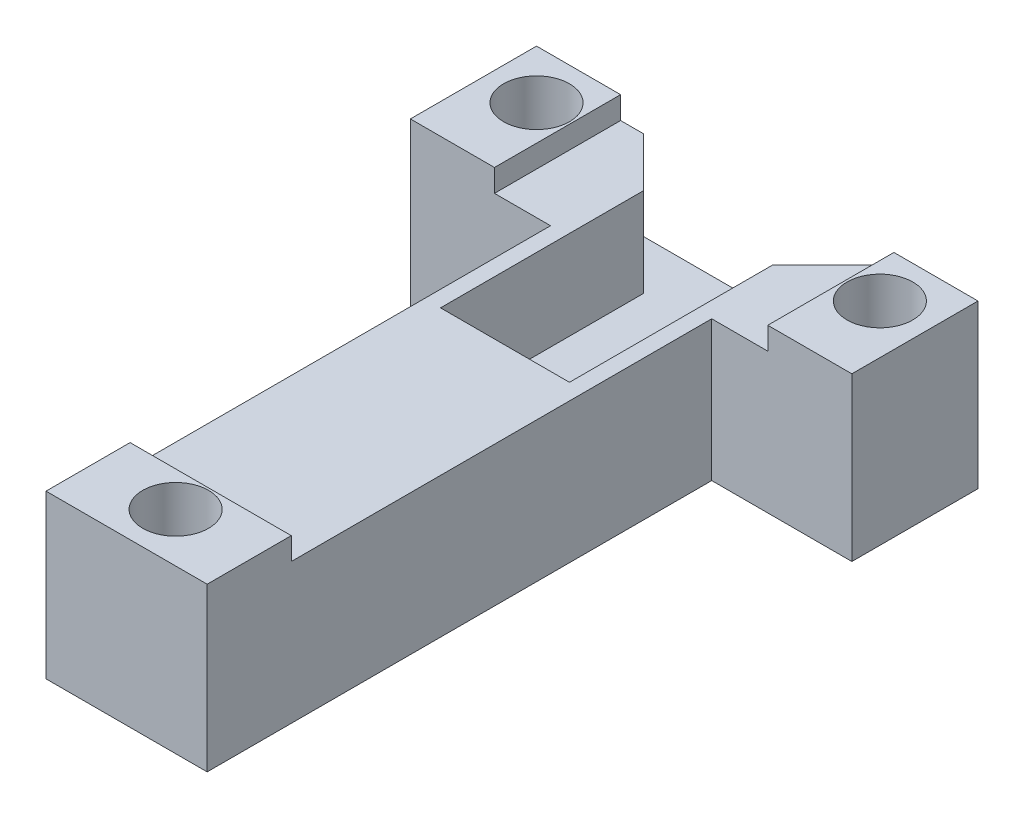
SolidWorks part; units mm, degrees
ref_plane "Front Plane" through (0, 0, 0) normal (0, 0, 1) x (1, 0, 0)
ref_plane "Top Plane" through (0, 0, 0) normal (0, 1, 0) x (1, 0, 0)
ref_plane "Right Plane" through (0, 0, 0) normal (1, 0, 0) x (0, 0, -1)
sketch "Sketch1" plane through (0, 0, 0) normal (0, 1, 0) x (1, 0, 0)
  line L0 (11.5, 45) -> (21.5, 45)
  line L1 (0, 0) -> (11.5, 0)
  line L2 (0, 0) -> (0, 45)
  line L3 (0, 45) -> (11.5, 45)
  line L4 (11.5, 0) -> (11.5, 45)
  line L5 (21.5, 45) -> (21.5, 36)
  line L6 (21.5, 36) -> (11.5, 36)
  line L7 (0, 45) -> (-10, 45)
  line L8 (-10, 45) -> (-10, 36)
  line L9 (-10, 36) -> (0, 36)
  dimension "D3" = 9
  dimension "D1" = 45
  dimension "D2" = 11.5
  dimension "D4" = 10
  dimension "D5" = 10
extrude "Boss-Extrude1" add sketch "Sketch1" along normal blind 10 contours L8 L9 L2 L7 | L6 L5 L0 L4
sketch "Sketch2" plane through (0, 10, 0) normal (0, 1, 0) x (1, 0, 0)
  line L0 (5.75, 0) -> (5.75, 45) construction
  line L3 (0, 36) -> (11.5, 36) construction
  line L4 (5.75, 36) -> (5.75, 27)
  line L5 (1.15, 27) -> (10.35, 27)
  line L6 (1.15, 27) -> (1.15, 45)
  line L7 (21.5, 45) -> (-10, 45) construction
  line L8 (10.35, 27) -> (10.35, 45)
  line L9 (1.15, 45) -> (10.35, 45)
  line L10 (0, 0) -> (11.5, 0) construction
  line L11 (-10, 45) -> (-10, 36) construction
  line L12 (21.5, 45) -> (21.5, 36) construction
  line L13 (1.15, 41.5) -> (-2.35, 45)
  line L14 (10.35, 41.5) -> (13.85, 45)
  circle A0 centre (5.75, 3.5) radius 2.3495
  circle A1 centre (-6.5, 41.5) radius 2.3495
  circle A2 centre (18, 41.5) radius 2.3495
  point P17 (5.75, 27)
  dimension "D1" = 4.699
  dimension "D9" = 4.699
  dimension "D10" = 4.699
  dimension "D2" = 9
  dimension "D3" = 9.2
  dimension "D4" = 3.5
  dimension "D5" = 3.5
  dimension "D6" = 3.5
  dimension "D7" = 3.5
  dimension "D8" = 3.5
  dimension "D11" = 3.5
  dimension "D12" = 3.5
  dimension "D13" = 3.5
  dimension "D14" = 3.5
extrude "Cut-Extrude1" cut sketch "Sketch2" against normal blind 6.35
sketch "Sketch3" plane through (0, 0, 0) normal (0, -1, 0) x (1, 0, 0)
  line L0 (5.75, 0) -> (5.75, -45) construction
  line L1 (0, 0) -> (11.5, 0) construction
  line L2 (21.5, -45) -> (-10, -45) construction
  circle A0 centre (5.75, -10) radius 2.3495
  circle A1 centre (5.75, -22) radius 2.3495
  dimension "D3" = 4.699
  dimension "D4" = 4.699
  dimension "D1" = 10
  dimension "D2" = 12
extrude "Cut-Extrude2" cut sketch "Sketch3" against normal blind 6.35
sketch "Sketch4" plane through (0, 10, 0) normal (0, 1, 0) x (1, 0, 0)
  line L0 (-4, 36) -> (-4, 45)
  line L1 (-10, 36) -> (0, 36) construction
  line L2 (-2.35, 45) -> (-10, 45) construction
  line L3 (15.5, 36) -> (15.5, 45)
  line L4 (21.5, 36) -> (11.5, 36) construction
  line L5 (21.5, 45) -> (13.85, 45) construction
  line L6 (0, 6) -> (11.5, 6)
  line L7 (0, 0) -> (0, 36) construction
  line L8 (11.5, 0) -> (11.5, 36) construction
  line L9 (0, 0) -> (11.5, 0) construction
  line L10 (-10, 45) -> (-10, 36) construction
  line L11 (21.5, 45) -> (21.5, 36) construction
  dimension "D1" = 6
  dimension "D2" = 6
  dimension "D3" = 6
extrude "Boss-Extrude2" add sketch "Sketch4" along normal blind 1.6 contours L0 M11 M9 M10 M5 | L3 M15 M16 M17 M6 | L6 M12 M13 M14 M4
